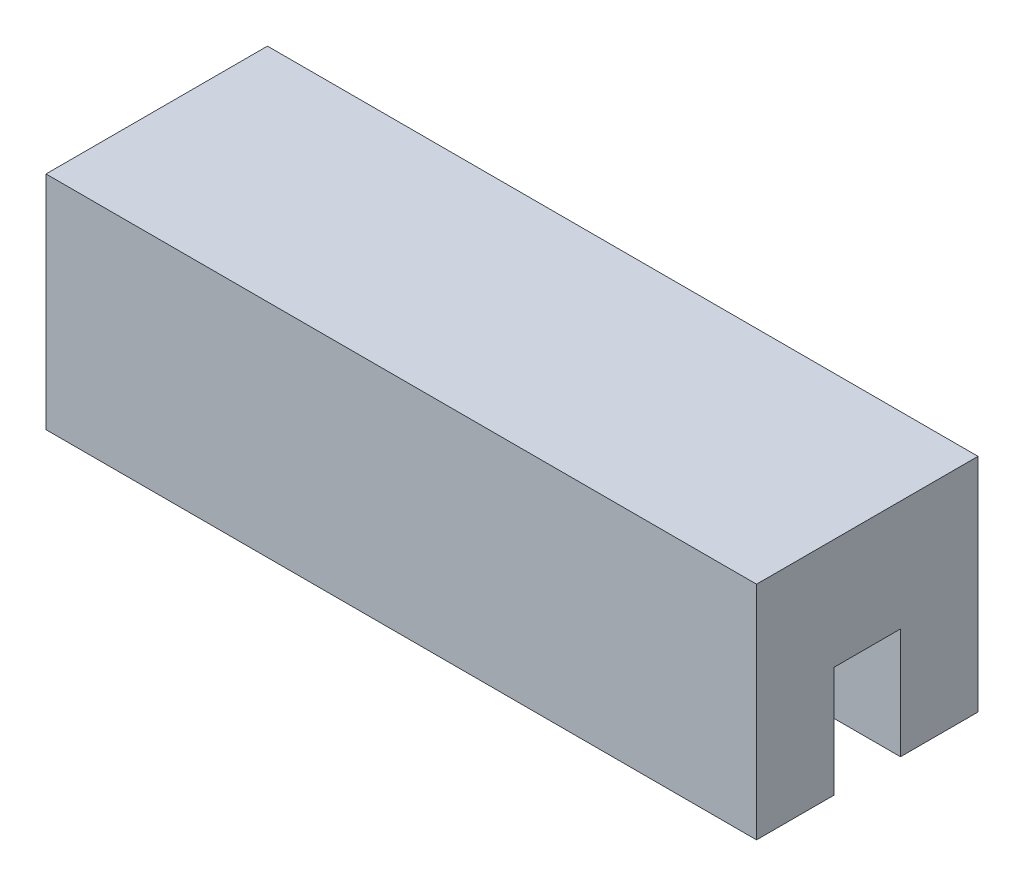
SolidWorks part; units mm, degrees
ref_plane "Front Plane" through (0, 0, 0) normal (0, 0, 1) x (1, 0, 0)
ref_plane "Top Plane" through (0, 0, 0) normal (0, 1, 0) x (1, 0, 0)
ref_plane "Right Plane" through (0, 0, 0) normal (1, 0, 0) x (0, 0, -1)
sketch "Sketch2" plane through (0, 0, 0) normal (1, 0, 0) x (0, 0, -1)
  line L1 (-12, 12) -> (12, 12)
  line L2 (-12, 12) -> (-12, -12)
  line L3 (-12, -12) -> (12, -12)
  line L4 (12, 12) -> (12, -12)
  line L5 (-12, 12) -> (12, -12) construction
  line L6 (-12, -12) -> (12, 12) construction
  point P0 (0, 0)
extrude "Boss-Extrude1" add sketch "Sketch2" along normal blind 77
sketch "Sketch3" plane through (77, 0, 0) normal (1, 0, 0) x (0, 0, -1)
  line L0 (-12, -12) -> (12, -12) construction
  line L1 (0, 0) -> (3.6, 0)
  line L2 (0, 0) -> (0, -12)
  line L3 (0, -12) -> (3.6, -12)
  line L4 (3.6, 0) -> (3.6, -12)
extrude "Cut-Extrude3" cut sketch "Sketch3" against normal up to surface (77 mm away)
mirror "Mirror1" about plane through (0, 0, 0) normal (0, 0, 1) of "Cut-Extrude3"
sketch "Sketch4" plane through (0, 0, -12) normal (0, 0, 1) x (1, 0, 0)
  line L0 (77, -12) -> (0, -12) construction
  line L5 (0, -12) -> (0, 12) construction
  circle A0 centre (40, 2) radius 2.1
  circle A1 centre (22.5, -6) radius 4.5
  circle A2 centre (5, 2) radius 2.1
  dimension "D1" = 4.2
  dimension "D2" = 4.2
  dimension "D7" = 9
  dimension "D8" = 0
  dimension "D9" = 5
  dimension "D4" = 6
  dimension "D3" = 35
  dimension "D5" = 19.2419
  dimension "D6" = 19.2419
extrude "Cut-Extrude4" cut sketch "Sketch4" along normal up to surface (8.4 mm away)
equation "\"rail width\"= 24"
equation "\"system width\"= 125"
equation "\"system depth\"= 250"
equation "\"internal height\"= 100"
equation "\"carriage height\"= 24"
equation "\"belt width\"= 6"
equation "\"worm gear diameter\"= 8"
equation "\"D1@Sketch2\"=\"rail width\""
equation "\"D2@Sketch2\"=\"rail width\""
equation "\"D1@Boss-Extrude1\"=\"system width\"-(2*\"rail width\")"
equation "\"D1@Sketch3\"=\"belt width\"*0.6"
